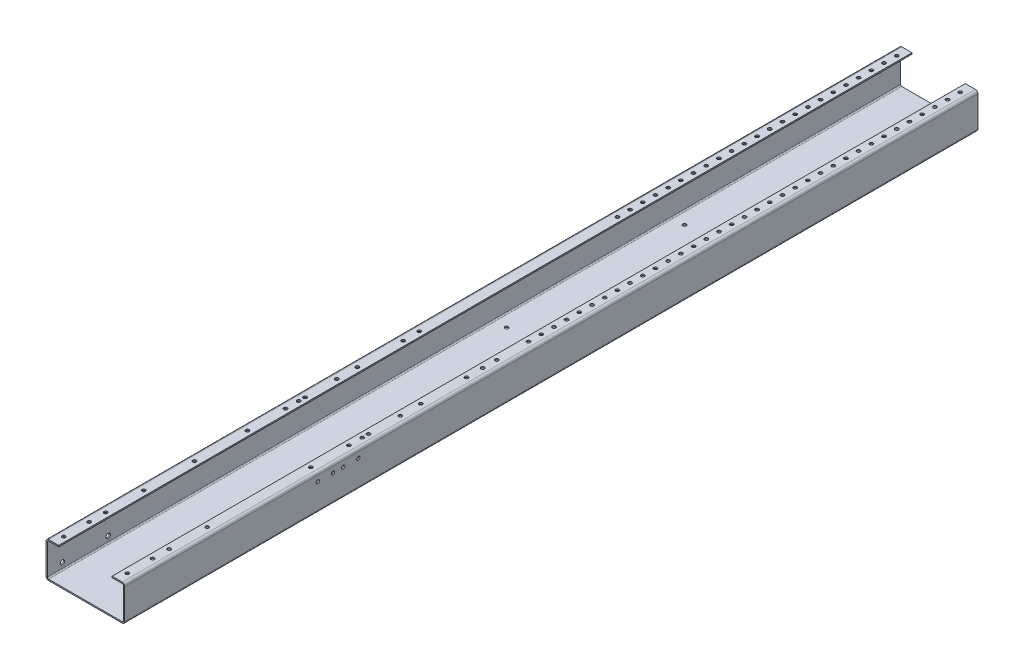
SolidWorks part; units mm, degrees
other "<PS030900>-<Trou taraudé M41>"
ref_plane "Plan de face" through (0, 0, 0) normal (0, 0, 1) x (1, 0, 0)
ref_plane "Plan de dessus" through (0, 0, 0) normal (0, 1, 0) x (1, 0, 0)
ref_plane "Plan de droite" through (0, 0, 0) normal (1, 0, 0) x (0, 0, -1)
mirrored part "PS030900_Rendre symétrique"
